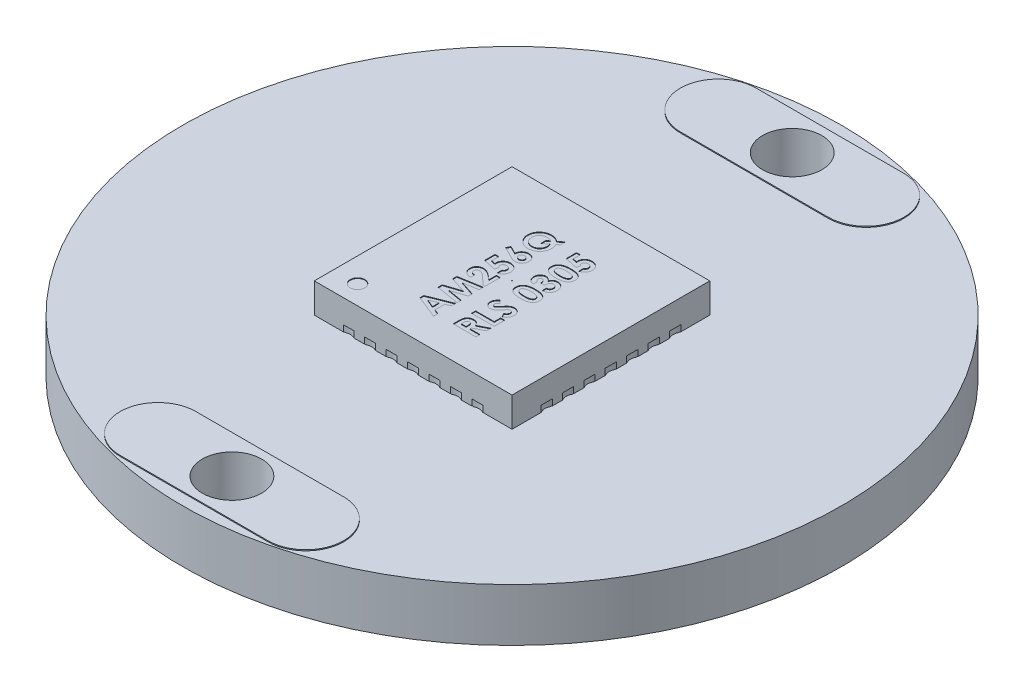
SolidWorks part; units mm, degrees
ref_plane "Plane1" through (0, 0, 0) normal (0, 0, 1) x (1, 0, 0)
ref_plane "Plane2" through (0, 0, 0) normal (0, 1, 0) x (1, 0, 0)
ref_plane "Plane3" through (0, 0, 0) normal (1, 0, 0) x (0, 0, -1)
sketch "Sketch1" plane through (0, 0, 0) normal (0, 1, 0) x (1, 0, 0)
  line L0 (0, 6) -> (6, 0) construction
  line L1 (0, 0) -> (6, 0)
  line L2 (0, 0) -> (0, 6)
  line L3 (0, 6) -> (6, 6)
  line L4 (6, 0) -> (6, 6)
  line L5 (6, 6) -> (0, 0) construction
  circle A0 centre (3, 3) radius 0.0106
  dimension "D1" = 6
  dimension "D2" = 6
extrude "Base-Extrude" add sketch "Sketch1" along normal blind 0.9
sketch "Sketch2" plane through (0, 0, 0) normal (0, -1, 0) x (1, 0, 0)
  line L0 (0.8008, -0.8) -> (5.2008, -0.8)
  line L1 (5.2008, -0.8) -> (5.2008, -5.2)
  line L2 (5.2008, -5.2) -> (0.8008, -5.2)
  line L3 (0.8008, -5.2) -> (0.8008, -0.8)
  line L4 (6, 0) -> (6, -6) construction
  line L5 (0, 0) -> (6, 0) construction
  line L6 (0.0008, -3.5) -> (0.5008, -3.5)
  line L7 (0.5008, -3.5) -> (0.5008, -3.8)
  line L8 (0.5008, -3.8) -> (0.0008, -3.8)
  line L9 (0.0008, -3.8) -> (0.0008, -3.5)
  line L11 (1.8508, -6) -> (1.8508, -5.5)
  line L12 (1.8508, -5.5) -> (1.5508, -5.5)
  line L13 (1.5508, -5.5) -> (1.5508, -6)
  line L14 (1.5508, -6) -> (1.8508, -6)
  line L15 (1.2008, -6) -> (1.2008, -5.5)
  line L16 (1.2008, -5.5) -> (0.9008, -5.5)
  line L17 (0.9008, -5.5) -> (0.9008, -6)
  line L18 (0.9008, -6) -> (1.2008, -6)
  line L19 (0.0008, -4.8) -> (0.5008, -4.8)
  line L20 (0.5008, -4.8) -> (0.5008, -5.1)
  line L21 (0.5008, -5.1) -> (0.0008, -5.1)
  line L22 (0.0008, -5.1) -> (0.0008, -4.8)
  line L23 (0.0008, -4.15) -> (0.5008, -4.15)
  line L24 (0.5008, -4.15) -> (0.5008, -4.45)
  line L25 (0.5008, -4.45) -> (0.0008, -4.45)
  line L26 (0.0008, -4.45) -> (0.0008, -4.15)
  line L27 (5.47, -0.1167) -> (5.87, -0.1167)
  line L28 (5.87, -0.1167) -> (5.87, -0.5167)
  line L29 (5.87, -0.5167) -> (5.47, -0.5167)
  line L30 (5.47, -0.5167) -> (5.47, -0.1167)
  line L31 (0.9008, 0) -> (1.2008, 0)
  line L32 (0.9008, -0.5) -> (0.9008, 0)
  line L33 (1.2008, 0) -> (1.2008, -0.5)
  line L34 (1.2008, -0.5) -> (0.9008, -0.5)
  line L35 (1.5508, 0) -> (1.8508, 0)
  line L36 (1.5508, -0.5) -> (1.5508, 0)
  line L37 (1.8508, 0) -> (1.8508, -0.5)
  line L38 (1.8508, -0.5) -> (1.5508, -0.5)
  line L39 (0.0008, -0.9) -> (0.5008, -0.9)
  line L40 (0.5008, -0.9) -> (0.5008, -1.2)
  line L41 (0.5008, -1.2) -> (0.0008, -1.2)
  line L42 (0.0008, -1.2) -> (0.0008, -0.9)
  line L43 (0.0008, -1.55) -> (0.5008, -1.55)
  line L44 (0.5008, -1.55) -> (0.5008, -1.85)
  line L45 (0.5008, -1.85) -> (0.0008, -1.85)
  line L46 (0.0008, -1.85) -> (0.0008, -1.55)
  line L47 (0.0008, -2.2) -> (0.5008, -2.2)
  line L48 (0.5008, -2.2) -> (0.5008, -2.5)
  line L49 (0.5008, -2.5) -> (0.0008, -2.5)
  line L50 (0.0008, -2.5) -> (0.0008, -2.2)
  line L51 (0.0008, -2.85) -> (0.5008, -2.85)
  line L52 (0.5008, -2.85) -> (0.5008, -3.15)
  line L53 (0.5008, -3.15) -> (0.0008, -3.15)
  line L54 (0.0008, -3.15) -> (0.0008, -2.85)
  line L55 (5.5008, -3.5) -> (5.5008, -3.8)
  line L56 (6.0008, -3.8) -> (6.0008, -3.5)
  line L58 (5.5008, -3.8) -> (6.0008, -3.8)
  line L59 (5.5008, -4.15) -> (5.5008, -4.45)
  line L60 (6.0008, -4.15) -> (5.5008, -4.15)
  line L61 (5.5008, -4.45) -> (6.0008, -4.45)
  line L62 (6.0008, -4.45) -> (6.0008, -4.15)
  line L63 (5.5008, -4.8) -> (5.5008, -5.1)
  line L64 (6.0008, -4.8) -> (5.5008, -4.8)
  line L65 (5.5008, -5.1) -> (6.0008, -5.1)
  line L66 (6.0008, -5.1) -> (6.0008, -4.8)
  line L67 (3.8008, -6) -> (3.8008, -5.5)
  line L68 (3.8008, -5.5) -> (3.5008, -5.5)
  line L69 (3.5008, -5.5) -> (3.5008, -6)
  line L70 (3.5008, -6) -> (3.8008, -6)
  line L71 (4.4508, -6) -> (4.4508, -5.5)
  line L72 (4.4508, -5.5) -> (4.1508, -5.5)
  line L73 (4.1508, -5.5) -> (4.1508, -6)
  line L74 (4.1508, -6) -> (4.4508, -6)
  line L75 (5.1008, -6) -> (5.1008, -5.5)
  line L76 (5.1008, -5.5) -> (4.8008, -5.5)
  line L77 (4.8008, -5.5) -> (4.8008, -6)
  line L78 (4.8008, -6) -> (5.1008, -6)
  line L79 (3.1508, -6) -> (3.1508, -5.5)
  line L80 (3.1508, -5.5) -> (2.8508, -5.5)
  line L81 (2.8508, -5.5) -> (2.8508, -6)
  line L82 (2.8508, -6) -> (3.1508, -6)
  line L83 (2.5008, -6) -> (2.5008, -5.5)
  line L84 (2.5008, -5.5) -> (2.2008, -5.5)
  line L85 (2.2008, -5.5) -> (2.2008, -6)
  line L86 (2.2008, -6) -> (2.5008, -6)
  line L87 (6.0008, -0.9) -> (5.5008, -0.9)
  line L88 (6.0008, -3.15) -> (6.0008, -2.85)
  line L89 (5.5008, -3.15) -> (6.0008, -3.15)
  line L90 (6.0008, -2.85) -> (5.5008, -2.85)
  line L91 (5.5008, -2.85) -> (5.5008, -3.15)
  line L92 (5.5008, -2.2) -> (5.5008, -2.5)
  line L93 (6.0008, -2.2) -> (5.5008, -2.2)
  line L94 (5.5008, -2.5) -> (6.0008, -2.5)
  line L95 (6.0008, -2.5) -> (6.0008, -2.2)
  line L96 (5.5008, -1.55) -> (5.5008, -1.85)
  line L97 (6.0008, -1.55) -> (5.5008, -1.55)
  line L98 (5.5008, -1.85) -> (6.0008, -1.85)
  line L99 (6.0008, -1.85) -> (6.0008, -1.55)
  line L100 (5.5008, -1.2) -> (6.0008, -1.2)
  line L101 (6.0008, -3.5) -> (5.5008, -3.5)
  line L102 (5.5008, -0.9) -> (5.5008, -1.2)
  line L103 (6.0008, -1.2) -> (6.0008, -0.9)
  line L104 (2.2008, 0) -> (2.5008, 0)
  line L105 (2.2008, -0.5) -> (2.2008, 0)
  line L106 (2.5008, 0) -> (2.5008, -0.5)
  line L107 (2.5008, -0.5) -> (2.2008, -0.5)
  line L108 (4.8008, 0) -> (5.1008, 0)
  line L109 (4.8008, -0.5) -> (4.8008, 0)
  line L110 (5.1008, 0) -> (5.1008, -0.5)
  line L111 (5.1008, -0.5) -> (4.8008, -0.5)
  line L112 (4.1508, 0) -> (4.4508, 0)
  line L113 (4.1508, -0.5) -> (4.1508, 0)
  line L114 (4.4508, 0) -> (4.4508, -0.5)
  line L115 (4.4508, -0.5) -> (4.1508, -0.5)
  line L116 (3.5008, 0) -> (3.8008, 0)
  line L117 (3.5008, -0.5) -> (3.5008, 0)
  line L118 (3.8008, 0) -> (3.8008, -0.5)
  line L119 (3.8008, -0.5) -> (3.5008, -0.5)
  line L120 (2.8508, -0.5) -> (2.8508, 0)
  line L121 (3.1508, 0) -> (3.1508, -0.5)
  line L122 (2.8508, 0) -> (3.1508, 0)
  line L123 (3.1508, -0.5) -> (2.8508, -0.5)
  circle A0 centre (3, -3) radius 0.005
  dimension "D2" = 3
  dimension "D3" = 0.01
  dimension "D1" = 3
extrude "Boss-Extrude1" add sketch "Sketch2" along normal blind 0.01
sketch "Sketch3" plane through (0, -0.01, 0) normal (0, -1, 0) x (1, 0, 0)
  line L3 (3.1508, 0) -> (3.5008, 0) construction
  circle A0 centre (4.9459, 0.25) radius 0.3
  circle A1 centre (4.2959, 0.25) radius 0.3
  circle A2 centre (3.6459, 0.25) radius 0.3
  circle A3 centre (2.9959, 0.25) radius 0.3
  circle A4 centre (2.3459, 0.25) radius 0.3
  circle A5 centre (1.6959, 0.25) radius 0.3
  circle A6 centre (1.0459, 0.25) radius 0.3
  circle A7 centre (4.9459, -6.25) radius 0.3
  circle A8 centre (4.2959, -6.25) radius 0.3
  circle A9 centre (3.6459, -6.25) radius 0.3
  circle A10 centre (2.9959, -6.25) radius 0.3
  circle A11 centre (2.3459, -6.25) radius 0.3
  circle A12 centre (1.6959, -6.25) radius 0.3
  circle A13 centre (1.0459, -6.25) radius 0.3
  circle A14 centre (-0.2541, -1.05) radius 0.3
  circle A15 centre (6.2459, -1.7) radius 0.3
  circle A16 centre (6.2459, -1.05) radius 0.3
  circle A17 centre (-0.2541, -1.7) radius 0.3
  circle A18 centre (6.2459, -2.35) radius 0.3
  circle A19 centre (-0.2541, -2.35) radius 0.3
  circle A20 centre (6.2459, -3) radius 0.3
  circle A21 centre (-0.2541, -3) radius 0.3
  circle A22 centre (6.2459, -3.65) radius 0.3
  circle A23 centre (-0.2541, -3.65) radius 0.3
  circle A24 centre (6.2459, -4.3) radius 0.3
  circle A25 centre (-0.2541, -4.3) radius 0.3
  circle A26 centre (6.2459, -4.95) radius 0.3
  circle A27 centre (-0.2541, -4.95) radius 0.3
  dimension "D1" = 0.6
  dimension "D2" = 0.25
extrude "Cut-Extrude1" cut sketch "Sketch3" against normal blind 0.2
sketch "Sketch4" plane through (0, 0.9, 0) normal (0, 1, 0) x (-1, 0, 0)
  line L0 (-2.7336, -0.3587) -> (-2.7336, -5.3322) construction
  text T0 "AM256Q  RLS 0305" font "Century Gothic" height 0.6879
extrude "Cut-Extrude2" cut sketch "Sketch4" against normal blind 0.02
sketch "Sketch5" plane through (0, 0.9, 0) normal (0, 1, 0) x (-1, 0, 0)
  circle A0 centre (-0.7301, -0.5825) radius 0.22
extrude "Cut-Extrude3" cut sketch "Sketch5" against normal blind 0.02
sketch "Sketch6" plane through (0, -0.01, 0) normal (0, -1, 0) x (1, 0, 0)
  line L0 (6, -5.1219) -> (6, -6) construction
  line L1 (4.5, -1.5) -> (1.5, -1.5)
  line L2 (4.5, -1.5) -> (4.5, -4.5)
  line L3 (4.5, -4.5) -> (1.5, -4.5)
  line L4 (1.5, -1.5) -> (1.5, -4.5)
  line L5 (0.8801, -6) -> (0, -6) construction
  dimension "D1" = 3
  dimension "D2" = 3
  dimension "D3" = 1.5
  dimension "D4" = 1.5
extrude "Cut-Extrude4" cut sketch "Sketch6" against normal blind 0.55
sketch "Sketch7" plane through (0, -0.01, 0) normal (0, -1, 0) x (1, 0, 0)
  line L1 (5.2008, -0.8) -> (0.8008, -0.8)
  line L2 (5.2008, -0.8) -> (5.2008, -5.2)
  line L3 (5.2008, -5.2) -> (0.8008, -5.2)
  line L4 (0.8008, -0.8) -> (0.8008, -5.2)
extrude "Boss-Extrude2" add sketch "Sketch7" against normal blind 0.3
sketch "Sketch9" plane through (0, -0.01, 0) normal (0, -1, 0) x (1, 0, 0)
  line L4 (0.8008, -0.8) -> (5.2008, -5.2) construction
  line L5 (5.2008, -0.8) -> (0.8008, -5.2) construction
  line L6 (3.0008, -3) -> (3.0008, -11.5) construction
  line L7 (3.0008, -3) -> (3.0008, 5.5) construction
  circle A0 centre (3.0008, -3) radius 10
  circle A1 centre (3.0008, -11.5) radius 0.9
  circle A2 centre (3.0008, 5.5) radius 0.9
  point P7 (3.2679, -11.4958)
  dimension "D2" = 8.5
  dimension "D3" = 8.5
  dimension "D4" = 1.8
  dimension "D5" = 1.8
extrude "Boss-Extrude3" add sketch "Sketch9" along normal blind 1.6
sketch "Sketch11" plane through (0, -1.61, 0) normal (0, -1, 0) x (1, 0, 0)
  line L0 (0.7508, -11.5) -> (5.2508, -11.5) construction
  line L1 (0.7508, -10.35) -> (5.2508, -10.35)
  line L2 (0.7508, -12.65) -> (5.2508, -12.65)
  line L3 (0.7508, 5.5) -> (5.2508, 5.5) construction
  line L4 (6.5008, -6.1) -> (6.5008, -7)
  line L5 (6.5008, -7.6) -> (9.0008, -7.6)
  line L6 (6.5008, -7.6) -> (6.5008, -8.5)
  line L7 (6.5008, -8.5) -> (9.0008, -8.5)
  line L8 (9.0008, -7.6) -> (9.0008, -8.5)
  line L9 (9.0008, -6.1) -> (9.0008, -7)
  line L10 (6.5008, -6.1) -> (9.0008, -6.1)
  line L11 (6.5008, -7) -> (9.0008, -7)
  line L12 (6.5008, -4.6) -> (6.5008, -5.5)
  line L13 (9.0008, -4.6) -> (9.0008, -5.5)
  line L14 (6.5008, -4.6) -> (9.0008, -4.6)
  line L15 (6.5008, -5.5) -> (9.0008, -5.5)
  line L16 (6.5008, -3.1) -> (6.5008, -4)
  line L17 (9.0008, -3.1) -> (9.0008, -4)
  line L18 (6.5008, -3.1) -> (9.0008, -3.1)
  line L19 (6.5008, -4) -> (9.0008, -4)
  line L28 (0.7508, 6.65) -> (5.2508, 6.65)
  line L29 (0.7508, 4.35) -> (5.2508, 4.35)
  circle A0 centre (3.0008, -11.5) radius 0.9
  circle A1 centre (3.0008, 5.5) radius 0.9
  arc A2 (0.7508, -10.35) -> (0.7508, -12.65) centre (0.7508, -11.5) ccw
  arc A3 (5.2508, -12.65) -> (5.2508, -10.35) centre (5.2508, -11.5) ccw
  arc A4 (0.7508, 6.65) -> (0.7508, 4.35) centre (0.7508, 5.5) ccw
  arc A5 (5.2508, 4.35) -> (5.2508, 6.65) centre (5.2508, 5.5) ccw
  circle A6 centre (3.0008, -3) radius 10 construction
  circle A7 centre (3.0008, -11.5) radius 0.9 construction
  circle A8 centre (3.0008, 5.5) radius 0.9 construction
  point P9 (3.0008, -11.5)
  point P40 (3.0008, 5.5)
  dimension "D1" = 2.3
  dimension "D2" = 2.3
  dimension "D3" = 4
  dimension "D5" = 1.5
  dimension "D6" = 3.5
  dimension "D7" = 5.5
  dimension "D4" = 2.5
  dimension "D8" = 4.5
  dimension "D9" = 4.5
  dimension "D10" = 0.9
extrude "Boss-Extrude5" add sketch "Sketch11" along normal blind 0.03
sketch "Sketch13" plane through (0, -1.61, 0) normal (0, -1, 0) x (1, 0, 0)
  line L8 (-2.5931, 0.1082) -> (-0.5931, 0.1082)
  line L9 (-2.5931, 1.9082) -> (-0.5931, 1.9082)
  line L10 (-2.5931, 1.9082) -> (-2.5931, 0.6582)
  line L11 (-2.5931, 0.6582) -> (-0.5931, 0.6582)
  line L12 (-0.5931, 1.9082) -> (-0.5931, 0.6582)
  line L13 (-2.5931, 0.1082) -> (-2.5931, -1.1418)
  line L14 (-2.5931, -1.1418) -> (-0.5931, -1.1418)
  line L15 (-0.5931, 0.1082) -> (-0.5931, -1.1418)
  line L16 (-2.5931, -1.6918) -> (-0.5931, -1.6918)
  line L17 (-2.5931, -1.6918) -> (-2.5931, -2.9418)
  line L18 (-2.5931, -2.9418) -> (-0.5931, -2.9418)
  line L19 (-0.5931, -1.6918) -> (-0.5931, -2.9418)
  line L20 (-2.5931, -3.4918) -> (-0.5931, -3.4918)
  line L21 (-2.5931, -3.4918) -> (-2.5931, -4.7418)
  line L22 (-2.5931, -4.7418) -> (-0.5931, -4.7418)
  line L23 (-0.5931, -3.4918) -> (-0.5931, -4.7418)
  line L24 (-2.5931, -5.2918) -> (-0.5931, -5.2918)
  line L25 (-2.5931, -5.2918) -> (-2.5931, -6.5418)
  line L26 (-2.5931, -6.5418) -> (-0.5931, -6.5418)
  line L27 (-0.5931, -5.2918) -> (-0.5931, -6.5418)
  line L28 (-2.5931, -7.0918) -> (-0.5931, -7.0918)
  line L29 (-2.5931, -7.0918) -> (-2.5931, -8.3418)
  line L30 (-2.5931, -8.3418) -> (-0.5931, -8.3418)
  line L31 (-0.5931, -7.0918) -> (-0.5931, -8.3418)
  point P12 (-1.9811, -7.8942)
  dimension "D3" = 2
  dimension "D4" = 1.25
  dimension "D5" = 6
extrude "Boss-Extrude7" add sketch "Sketch13" along normal blind 0.5
sketch "Sketch14" plane through (0, -1.61, 0) normal (0, -1, 0) x (1, 0, 0)
  line L1 (1.415, -2.924) -> (2.915, -2.924)
  line L2 (1.415, -2.924) -> (1.415, -5.924)
  line L3 (1.415, -5.924) -> (2.915, -5.924)
  line L4 (2.915, -2.924) -> (2.915, -5.924)
  dimension "D1" = 3
  dimension "D2" = 1.5
extrude "Boss-Extrude8" add sketch "Sketch14" along normal blind 1.8
sketch "Sketch15" plane through (0, -3.41, 0) normal (0, -1, 0) x (1, 0, 0)
  line L0 (1.415, -2.924) -> (1.415, -5.924) construction
  line L1 (1.415, -5.5232) -> (2.915, -5.5232)
  line L2 (1.415, -5.5232) -> (1.415, -5.4113)
  line L3 (1.415, -5.4113) -> (2.915, -5.4113)
  line L4 (2.915, -5.5232) -> (2.915, -5.4113)
  line L5 (2.915, -5.924) -> (2.915, -2.924) construction
extrude "Cut-Extrude5" cut sketch "Sketch15" against normal blind 0.01
sketch "Sketch16" plane through (0, -0.01, 0) normal (0, 1, 0) x (1, 0, 0)
  line L0 (5.2438, -5.5) -> (0.7578, -5.5) construction
  line L1 (5.2438, -6.65) -> (0.7578, -6.65)
  line L2 (5.2438, -4.35) -> (0.7578, -4.35)
  line L3 (5.2438, 11.5) -> (0.7578, 11.5) construction
  line L4 (5.2438, 10.35) -> (0.7578, 10.35)
  line L5 (5.2438, 12.65) -> (0.7578, 12.65)
  line L6 (0.7508, 12.65) -> (5.2508, 12.65) construction
  line L7 (5.2508, -6.65) -> (0.7508, -6.65) construction
  circle A0 centre (3.0008, 11.5) radius 0.9
  circle A1 centre (3.0008, -5.5) radius 0.9
  arc A2 (5.2438, -6.65) -> (5.2438, -4.35) centre (5.2438, -5.5) ccw
  arc A3 (0.7578, -4.35) -> (0.7578, -6.65) centre (0.7578, -5.5) ccw
  arc A4 (5.2438, 10.35) -> (5.2438, 12.65) centre (5.2438, 11.5) ccw
  arc A5 (0.7578, 12.65) -> (0.7578, 10.35) centre (0.7578, 11.5) ccw
  circle A6 centre (3.0008, 11.5) radius 0.9 construction
  circle A7 centre (3.0008, -5.5) radius 0.9 construction
  point P8 (3.0008, -5.5)
  point P14 (3.0008, 11.5)
  point P24 (0.7578, 11.5)
  point P29 (0.7578, -5.5)
extrude "Boss-Extrude9" add sketch "Sketch16" along normal blind 0.03
